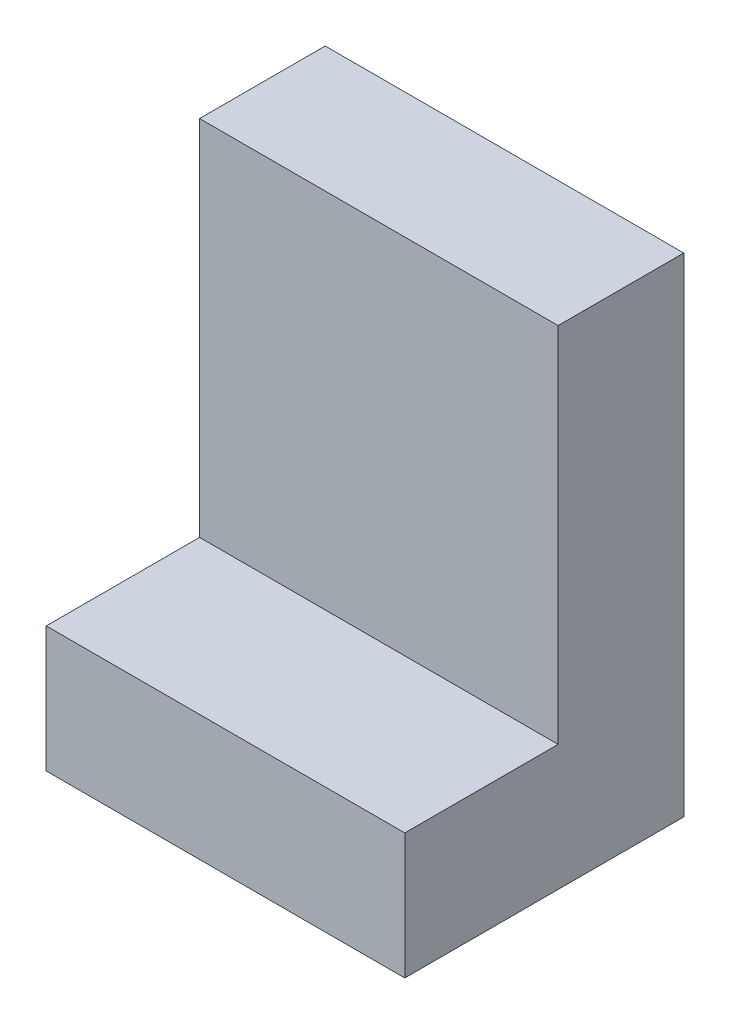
SolidWorks part; units mm, degrees
ref_plane "Plane1" through (0, 0, 0) normal (0, 0, 1) x (1, 0, 0)
ref_plane "Plane2" through (0, 0, 0) normal (0, 1, 0) x (1, 0, 0)
ref_plane "Plane3" through (0, 0, 0) normal (1, 0, 0) x (0, 0, -1)
sketch "Sketch1" plane through (0, 0, 0) normal (1, 0, 0) x (0, 0, -1)
  line L0 (0, 0) -> (38.9074, 0)
  line L1 (38.9074, 0) -> (38.9074, 68.1053)
  line L2 (38.9074, 68.1053) -> (21.3849, 68.1053)
  line L3 (21.3849, 68.1053) -> (21.3849, 17.5225)
  line L4 (21.3849, 17.5225) -> (0, 17.5225)
  line L5 (0, 17.5225) -> (0, 0)
extrude "Base-Extrude" add sketch "Sketch1" along normal blind 50
